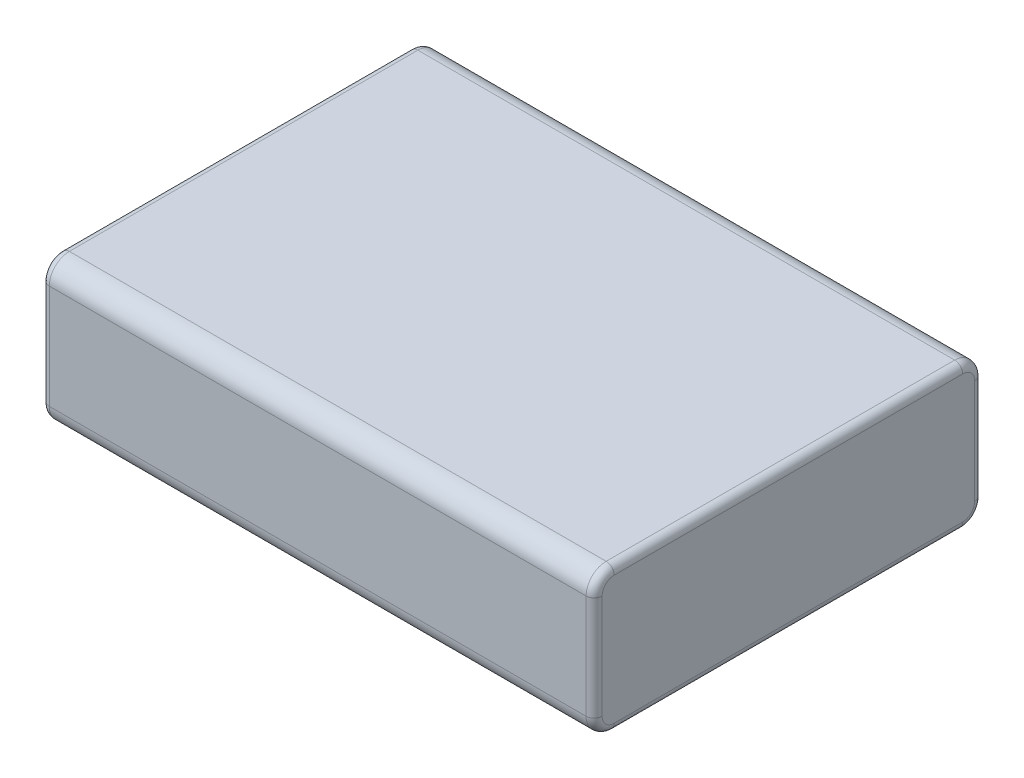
SolidWorks part; units mm, degrees
ref_plane "Plan de face" through (0, 0, 0) normal (0, 0, 1) x (1, 0, 0)
ref_plane "Plan de dessus" through (0, 0, 0) normal (0, 1, 0) x (1, 0, 0)
ref_plane "Plan de droite" through (0, 0, 0) normal (1, 0, 0) x (0, 0, -1)
sketch "Esquisse1" plane through (0, 0, 0) normal (0, 1, 0) x (1, 0, 0)
  line L1 (0, 0) -> (69, 0)
  line L2 (0, 0) -> (0, 48.5)
  line L3 (0, 48.5) -> (69, 48.5)
  line L4 (69, 0) -> (69, 48.5)
extrude "Boss.-Extru.1" add sketch "Esquisse1" along normal blind 18
fillet "Congé1" radius 2.5 4 edges at (34.5, 0, -48.5) (34.5, 18, -48.5) (34.5, 0, 0) (34.5, 18, 0)
fillet "Congé2" radius 1 16 edges at (0, 17.2678, -47.7678) (0, 9, -48.5) (0, 0.7322, -47.7678) (0, 0, -24.25) (0, 0.7322, -0.7322) (0, 9, 0) (0, 17.2678, -0.7322) (69, 17.2678, -0.7322) (69, 9, 0) (69, 0.7322, -0.7322) (69, 0, -24.25) (69, 0.7322, -47.7678) (69, 9, -48.5) (69, 17.2678, -47.7678) (0, 18, -24.25) (69, 18, -24.25)
sketch "Esquisse2" plane through (0, 0, 0) normal (0, -1, 0) x (1, 0, 0)
  line L0 (69, -55.4861) -> (69, 2.2216) construction
  line L1 (80.136, -48.5) -> (50.0314, -48.5) construction
  line L2 (80.136, -42) -> (54.0856, -42) construction
  line L3 (80.136, -33) -> (54.0856, -33) construction
  line L4 (65, -55.4861) -> (65, -31.1609) construction
  line L5 (60.5, -55.4861) -> (60.5, -29.7807) construction
  line L7 (60.5, -33) -> (65, -33)
  line L8 (60.5, -33) -> (60.5, -42)
  line L9 (60.5, -42) -> (65, -42)
  line L10 (65, -33) -> (65, -42)
  dimension "D1" = 4.5
  dimension "D2" = 4
  dimension "D3" = 9
  dimension "D4" = 6.5
extrude "Enlèv. mat.-Extru.1" cut sketch "Esquisse2" against normal blind 1
sketch "Esquisse3" plane through (0, 1, 0) normal (0, -1, 0) x (1, 0, 0)
  line L0 (65, -42) -> (65, -33) construction
  line L1 (61.25, -33.75) -> (64.25, -33.75)
  line L2 (61.25, -33.75) -> (61.25, -36.75)
  line L3 (61.25, -36.75) -> (64.25, -36.75)
  line L4 (64.25, -33.75) -> (64.25, -36.75)
  line L5 (65, -33) -> (60.5, -33) construction
  dimension "D1" = 0.75
  dimension "D2" = 0.75
extrude "Boss.-Extru.2" add sketch "Esquisse3" along normal blind 3
